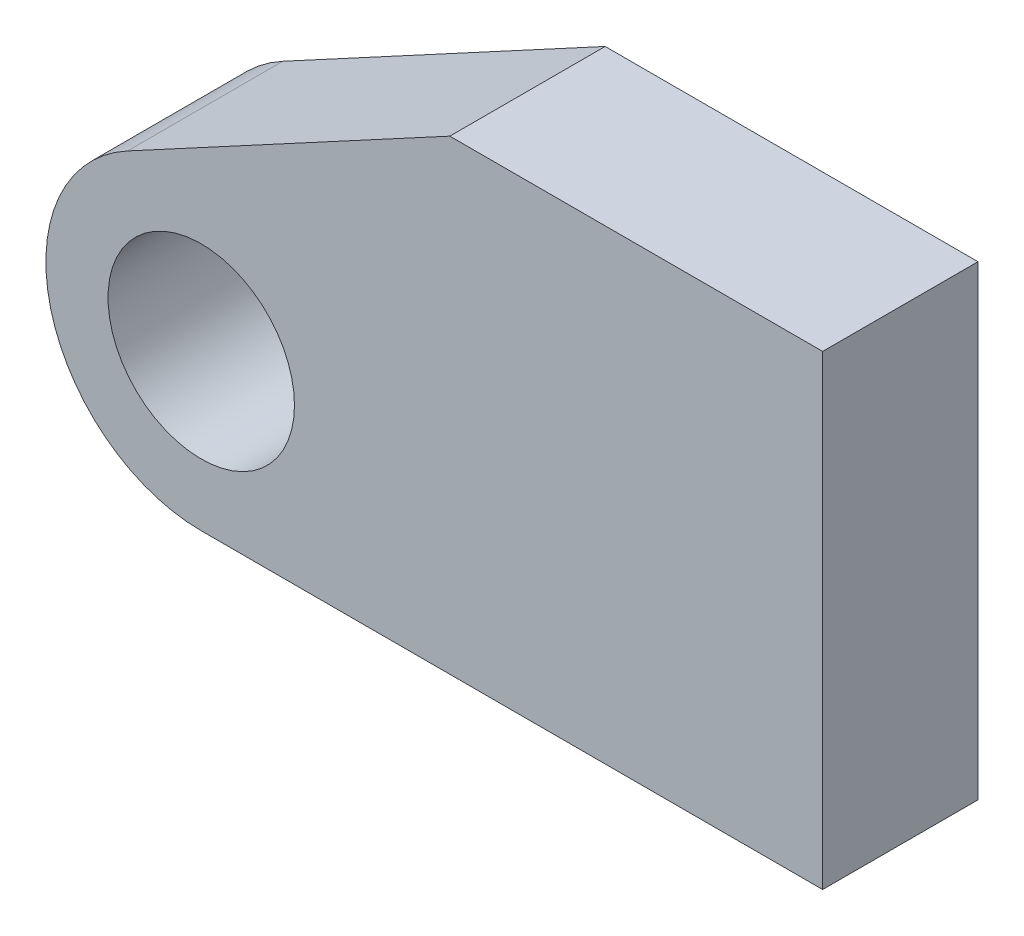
SolidWorks part; units mm, degrees
ref_plane "Plan de face" through (0, 0, 0) normal (0, 0, 1) x (1, 0, 0)
ref_plane "Plan de dessus" through (0, 0, 0) normal (0, 1, 0) x (1, 0, 0)
ref_plane "Plan de droite" through (0, 0, 0) normal (1, 0, 0) x (0, 0, -1)
sketch "Esquisse1" plane through (0, 0, 0) normal (0, 0, 1) x (1, 0, 0)
  line L0 (0, -50) -> (200, -50)
  line L1 (200, -50) -> (200, 100)
  line L2 (200, 100) -> (80, 100)
  line L3 (80, 100) -> (-23.7495, 43.9996)
  arc A0 (-23.7495, 43.9996) -> (0, -50) centre (0, 0) ccw
  circle A1 centre (0, 0) radius 30
  point P7 (-50, 0)
  dimension "D1" = 50
  dimension "D5" = 60
  dimension "D2" = 200
  dimension "D3" = 150
  dimension "D4" = 120
  dimension "D6" = 250
extrude "Extrusion1" add sketch "Esquisse1" along normal blind 50
